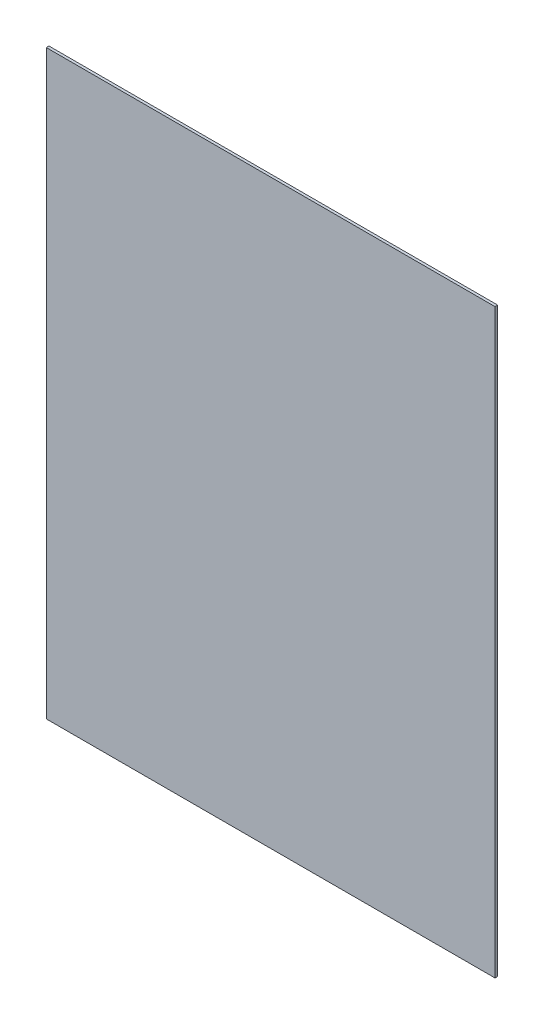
SolidWorks part; units mm, degrees
ref_plane "Alzado" through (0, 0, 0) normal (0, 0, 1) x (1, 0, 0)
ref_plane "Planta" through (0, 0, 0) normal (0, 1, 0) x (1, 0, 0)
ref_plane "Vista lateral" through (0, 0, 0) normal (1, 0, 0) x (0, 0, -1)
sketch "Sketch1" plane through (0, 0, 0) normal (0, 0, 1) x (1, 0, 0)
  line L1 (0, 0) -> (505.5, 0)
  line L2 (0, 0) -> (0, 655)
  line L3 (0, 655) -> (505.5, 655)
  line L4 (505.5, 0) -> (505.5, 655)
  dimension "D1" = 505.5
  dimension "D2" = 655
extrude "Boss-Extrude1" add sketch "Sketch1" along normal blind 3
